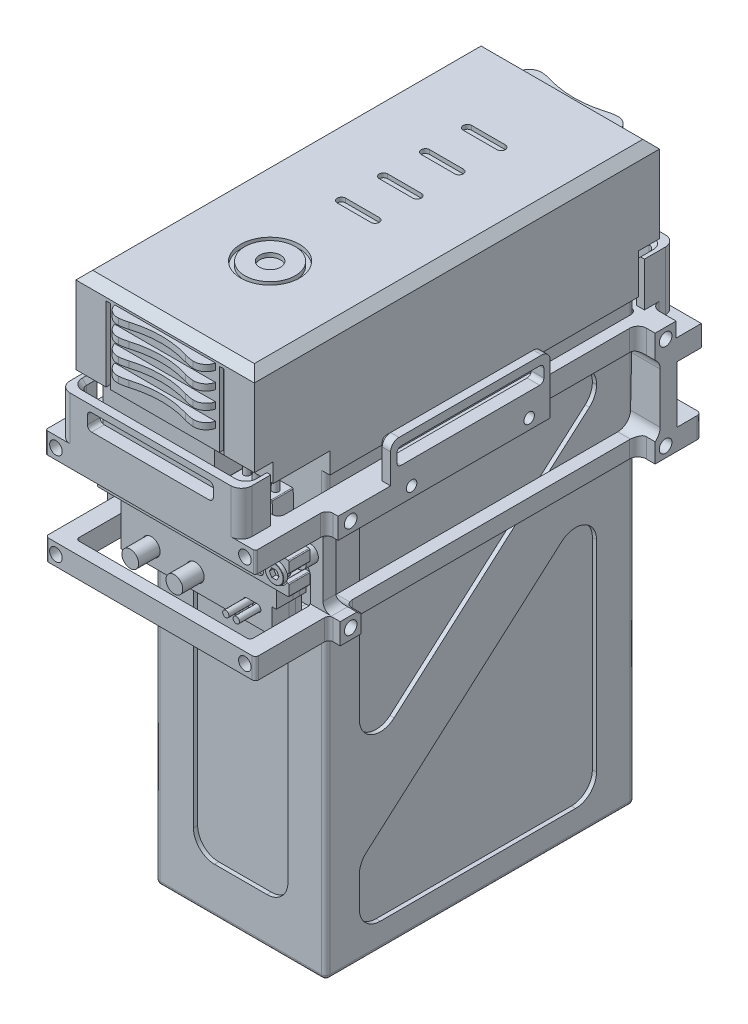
SolidWorks part; units mm, degrees
ref_plane "前视基准面" through (0, 0, 0) normal (0, 0, 1) x (1, 0, 0)
ref_plane "上视基准面" through (0, 0, 0) normal (0, 1, 0) x (1, 0, 0)
ref_plane "右视基准面" through (0, 0, 0) normal (1, 0, 0) x (0, 0, -1)
imported_body "大疆电池座2017-1-solid1"
imported_body "电池插座-大疆电池座-1-solid1"
imported_body "按键开关-大疆电池座-1-solid1" [suppressed]
imported_body "开关固定座-大疆电池座-1-solid1" [suppressed]
imported_body "凸肩螺丝-3-solid1" [suppressed]
imported_body "凸肩螺丝-4-solid1" [suppressed]
imported_body "开关固定座-大疆电池座-2-solid1" [suppressed]
imported_body "按键开关-大疆电池座-2-solid1" [suppressed]
imported_body "凸肩螺丝-1-solid1" [suppressed]
imported_body "凸肩螺丝-2-solid1" [suppressed]
imported_body "凸肩螺丝-5-solid1"
imported_body "凸肩螺丝-6-solid1"
hole_wizard "M3深6" positions "3D草图1" profile "草图1" hole size "Ø3.0" standard "GB"
sketch3d "3D草图1"
  line L0 (-22.5, 24.5, 45.75) -> (-22.5, 24.5, 51.75) construction
  line L1 (22.5, 24.5, 45.75) -> (22.5, 24.5, 51.75) construction
  line L2 (-22.5, 2.5, 45.75) -> (-22.5, 2.5, 51.75) construction
  line L3 (22.5, 2.5, 45.75) -> (22.5, 2.5, 51.75) construction
  line L4 (-22.5, 21, -45.75) -> (-22.5, 21, -51.75) construction
  line L5 (-22.5, 2.5, -45.75) -> (-22.5, 2.5, -51.75) construction
  line L6 (22.5, 2.5, -45.75) -> (22.5, 2.5, -51.75) construction
  line L7 (22.5, 21, -45.75) -> (22.5, 21, -51.75) construction
  point P0 (-22.5, 24.5, 51.75)
  point P4 (22.5, 24.5, 51.75)
  point P9 (-22.5, 2.5, 51.75)
  point P13 (22.5, 2.5, 51.75)
  point P17 (-22.5, 21, -51.75)
  point P21 (-22.5, 2.5, -51.75)
  point P25 (22.5, 2.5, -51.75)
  point P29 (22.5, 21, -51.75)
sketch "草图1" plane through (-22.5, 24.5, 51.75) normal (1, 0, 0) x (0, -1, 0)
  line L0 (0, 0) -> (0, 6.9013)
  line L1 (0, 6.9013) -> (1.5, 6)
  line L2 (1.5, 6) -> (1.5, 0)
  line L5 (1.5, 0) -> (0, 0)
  line L10 (0, 6.9013) -> (-1.5, 6) construction
  line L11 (0, -6.35) -> (0, 107.95) construction
  dimension "孔直径" = 3
  dimension "孔深度" = 6
  dimension "导头角度" = 118
hole_wizard "M3 深6" positions "3D草图2" profile "草图2" hole size "Ø3.0" standard "GB"
sketch3d "3D草图2"
  line L0 (-21.7, 24.5, -43.25) -> (-27.7, 24.5, -43.25) construction
  line L1 (-21.7, 2.5, -43.25) -> (-27.7, 2.5, -43.25) construction
  line L2 (-21.7, 24.5, 31.75) -> (-27.7, 24.5, 31.75) construction
  line L3 (-21.7, 2.5, 31.75) -> (-27.7, 2.5, 31.75) construction
  line L4 (21.7, 24.5, -43.25) -> (27.7, 24.5, -43.25) construction
  line L5 (21.7, 2.5, -43.25) -> (27.7, 2.5, -43.25) construction
  line L6 (21.7, 24.5, 31.75) -> (27.7, 24.5, 31.75) construction
  line L7 (21.7, 2.5, 31.75) -> (27.7, 2.5, 31.75) construction
  point P0 (-27.7, 24.5, -43.25)
  point P4 (-27.7, 2.5, -43.25)
  point P8 (-27.7, 24.5, 31.75)
  point P12 (-27.7, 2.5, 31.75)
  point P16 (27.7, 24.5, -43.25)
  point P20 (27.7, 2.5, -43.25)
  point P24 (27.7, 24.5, 31.75)
  point P28 (27.7, 2.5, 31.75)
sketch "草图2" plane through (-27.7, 24.5, -43.25) normal (0, 1, 0) x (0, 0, 1)
  line L0 (0, 0) -> (0, 6.9013)
  line L1 (0, 6.9013) -> (1.5, 6)
  line L2 (1.5, 6) -> (1.5, 0)
  line L5 (1.5, 0) -> (0, 0)
  line L10 (0, 6.9013) -> (-1.5, 6) construction
  line L11 (0, -6.35) -> (0, 107.95) construction
  dimension "孔直径" = 3
  dimension "孔深度" = 6
  dimension "导头角度" = 118
inserted part "电池-TBA7-白色"
move or copy body "实体-移动/复制2" bodies to move or copy 133 placed by mates yes
other "距离3" [suppressed] parameters "D1"=1.75
inserted part "电池-黑色" parameters "D1.凸台-拉伸1"=135, "D1.草图1"=40.5, "D2.草图1"=73.5, "D1.凸台-拉伸2"=1, "D1.草图2"=18, "D2.草图2"=20.5, "D3.草图2"=4.5, "D4.草图2"=30, "D5.草图2"=4.5, "D6.草图2"=20.5, "D7.草图2"=96.5, "D8.草图2"=0, "D1.凸台-拉伸3"=1, "D1.草图3"=0, "D1.凸台-拉伸4"=2.3, "D1.草图4"=1.5, "D2.草图4"=2.5, "D3.草图4"=24, "D4.草图4"=4, "D1.凸台-拉伸5"=2.3, "D1.草图5"=0, "D2.草图5"=0, "D4.草图5"=0, "D5.草图5"=0, "D1.切除-拉伸1"=18, "D1.草图6"=8, "D2.草图6"=23, "D1.切除-拉伸2"=18, "D1.草图7"=8, "D2.草图7"=23, "D1.圆角1"=10, "D1.圆角2"=10, "D1.圆角3"=3, "D1.圆角4"=3, "D1.倒角1"=2, "D2.倒角1"=45, "D1.切除-拉伸3"=1, "D1.切除-拉伸4"=1, "D1.草图9"=0, "D2.草图9"=0, "D1.圆角5"=1, "D1.圆角6"=1, "D1.凸台-拉伸6"=11, "D1.草图10"=26.5, "D2.草图10"=0, "D1.切除-拉伸5"=11, "D1.切除-拉伸6"=1, "D1.草图12"=45, "D2.草图12"=10, "D3.草图12"=8, "D4.草图12"=8, "D5.草图12"=80, "D6.草图12"=5, "D1.切除-拉伸7"=1, "D1.草图13"=10, "D2.草图13"=8, "D3.草图13"=8, "D4.草图13"=85, "D5.草图13"=5, "D1.切除-拉伸8"=1, "D1.草图14"=8, "D2.草图14"=7, "D3.草图14"=5, "D4.草图14"=90, "D5.草图14"=5, "D1.切除-拉伸9"=1, "D1.草图15"=0, "D2.草图15"=0, "D1.切除-拉伸10"=1, "D1.草图16"=25, "D2.草图16"=12, "D1.切除-拉伸11"=1, "D1.草图20"=5
move or copy body "实体-移动/复制3" bodies to move or copy 135 placed by mates yes
other "距离4" parameters "D1"=75
other "距离5" parameters "D1"=0.75
other "距离6" parameters "D1"=0.5
